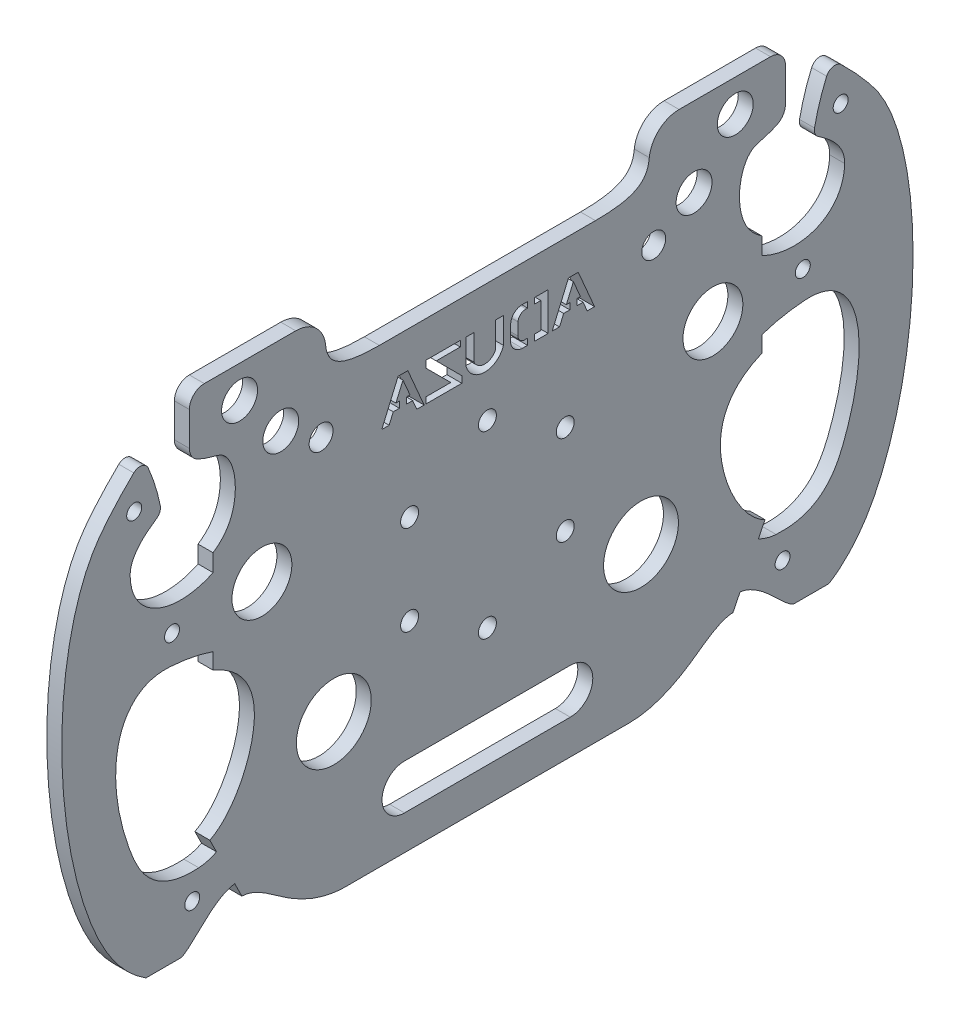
SolidWorks part; units mm, degrees
ref_plane "Front Plane" through (0, 0, 0) normal (0, 0, 1) x (1, 0, 0)
ref_plane "Top Plane" through (0, 0, 0) normal (0, 1, 0) x (1, 0, 0)
ref_plane "Right Plane" through (0, 0, 0) normal (1, 0, 0) x (0, 0, -1)
sketch "Sketch1" plane through (0, 0, 0) normal (1, 0, 0) x (0, 0, -1)
  line L0 (-119.7972, 154.2478) -> (520.2028, 154.2478) construction
sketch "Sketch2" plane through (0, 0, 0) normal (1, 0, 0) x (0, 0, -1)
  line L0 (0, 0) -> (0, -114.8232) construction
  line L1 (0, 0) -> (0, 135.3403) construction
  line L2 (36.0776, 77.2862) -> (-36.0776, 77.2862)
  line L3 (-91.6666, 13.2703) -> (-121.0851, 15.3716) construction
  line L4 (-63.9899, 95.4707) -> (-94.5192, 95.4707)
  line L5 (-99.5192, 90.4707) -> (-99.5192, 79.2297)
  line L6 (-93.4859, 73.1851) -> (-99.8854, 76.2618) construction
  line L7 (-114.505, 62.1949) -> (-114.0012, 39.5821) construction
  line L8 (-114.3916, 57.1045) -> (-114.0758, 42.93) construction
  line L9 (-110.3183, 14.6025) -> (-102.1435, 14.0186) construction
  line L10 (-104.6163, -39.1042) -> (-88.6872, -38.1199) construction
  line L11 (-89.9098, -38.1954) -> (-103.3938, -39.0286) construction
  line L12 (-47.4105, -73.6008) -> (47.4105, -73.6008)
  line L13 (-42.0447, -73.6008) -> (-52.7936, -73.6008) construction
  line L14 (-92.4432, -71.6519) -> (-109.4776, -71.6519) construction
  line L15 (114.0311, -71.6519) -> (102.2027, -71.6519)
  line L16 (99.5192, 90.4707) -> (99.5192, 79.2297)
  line L17 (63.9899, 95.4707) -> (94.5192, 95.4707)
  line L18 (-26.0151, 77.2862) -> (-46.1401, 77.2862) construction
  line L21 (-114.0311, -71.6519) -> (-102.2027, -71.6519)
  arc A0 (-54.0436, 86.5064) -> (-63.9899, 95.4707) centre (-63.9899, 85.4707) ccw
  arc A1 (-99.5192, 79.2297) -> (-96.6857, 74.7234) centre (-94.5192, 79.2297) ccw
  arc A2 (-94.5192, 95.4707) -> (-99.5192, 90.4707) centre (-94.5192, 90.4707) ccw
  arc A3 (-106.2246, 61.1913) -> (-103.9015, 66.2781) centre (-108.8336, 65.4567) ccw
  arc A4 (-110.5669, 86.4485) -> (-118.3195, 87.9515) centre (-115.027, 84.1886) ccw
  arc A5 (-116.6799, -70.8926) -> (-114.0311, -71.6519) centre (-114.0311, -66.6519) ccw
  arc A6 (116.6799, -70.8926) -> (114.0311, -71.6519) centre (114.0311, -66.6519) cw
  arc A7 (110.5669, 86.4485) -> (118.3195, 87.9515) centre (115.027, 84.1886) cw
  arc A8 (106.2246, 61.1913) -> (103.9015, 66.2781) centre (108.8336, 65.4567) cw
  arc A9 (94.5192, 95.4707) -> (99.5192, 90.4707) centre (94.5192, 90.4707) cw
  arc A10 (99.5192, 79.2297) -> (96.6857, 74.7234) centre (94.5192, 79.2297) cw
  arc A11 (54.0436, 86.5064) -> (63.9899, 95.4707) centre (63.9899, 85.4707) cw
  spline S0 degree 3 poles (-54.0436, 86.5064) (-53.7455, 83.6431) (-51.8652, 79.033) (-43.1803, 77.2862) (-36.0776, 77.2862) knots 0.310162 0.310162 0.310162 0.310162 0.655081 1 1 1 1
  spline S1 degree 3 poles (-96.6857, 74.7234) (-92.6846, 72.7998) (-84.6718, 73.4018) (-79.9826, 39.7627) (-113.9702, 38.1898) (-114.2851, 52.3228) knots 0 0 0 0 0.144743 0.476307 1 1 1 1
  spline S2 degree 3 poles (-114.2851, 52.3228) (-114.3139, 53.6179) (-112.9994, 56.3911) (-108.9403, 59.5302) (-106.2246, 61.1913) knots 0 0 0 0 0.431174 0.862348 0.862348 0.862348 0.862348
  spline S3 degree 3 poles (-110.5669, 86.4485) (-109.3772, 84.1006) (-106.5446, 77.7069) (-104.6414, 70.7208) (-103.9015, 66.2781) knots 0.195647 0.195647 0.195647 0.195647 0.445835 0.886101 0.886101 0.886101 0.886101
  spline S4 degree 3 poles (-118.3195, 87.9515) (-122.4147, 84.3682) (-127.0259, 79.5861) (-150.1062, 52.6286) (-151.2181, -14.6129) (-130.1901, -58.8432) (-122.0723, -67.5244) (-116.6799, -70.8926) knots 0.048714 0.048714 0.048714 0.048714 0.169988 0.25318 0.810911 0.891789 0.992245 0.992245 0.992245 0.992245
  spline S5 degree 3 poles (-106.2712, 14.3134) (-87.8846, 13.0001) (-68.2901, -3.3504) (-86.73, -37.999) (-96.6857, -38.6141) knots 0 0 0 0 0.501339 1 1 1 1
  spline S6 degree 3 poles (-106.2712, 14.3134) (-111.3804, 14.6784) (-115.5316, 11.4054) (-121.1809, -0.288) (-118.0643, -17.5033) (-110.8831, -34.6722) (-105.1132, -39.1349) (-96.6857, -38.6141) knots 0 0 0 0 0.114693 0.187207 0.665368 0.752624 1 1 1 1
  spline S7 degree 3 poles (-102.2027, -71.6519) (-96.9066, -71.6519) (-84.9595, -51.8628) (-66.8364, -68.7979) (-54.1285, -73.6008) (-47.4105, -73.6008) knots 0 0 0 0 0.325496 0.643297 1 1 1 1
  spline S8 degree 3 poles (102.2027, -71.6519) (96.9066, -71.6519) (84.9595, -51.8628) (66.8364, -68.7979) (54.1285, -73.6008) (47.4105, -73.6008) knots 0 0 0 0 0.325496 0.643297 1 1 1 1
  spline S9 degree 3 poles (106.2712, 14.3134) (111.3804, 14.6784) (115.5316, 11.4054) (121.1809, -0.288) (118.0643, -17.5033) (110.8831, -34.6722) (105.1132, -39.1349) (96.6857, -38.6141) knots 0 0 0 0 0.114693 0.187207 0.665368 0.752624 1 1 1 1
  spline S10 degree 3 poles (106.2712, 14.3134) (87.8846, 13.0001) (68.2901, -3.3504) (86.73, -37.999) (96.6857, -38.6141) knots 0 0 0 0 0.501339 1 1 1 1
  spline S11 degree 3 poles (118.3195, 87.9515) (122.4147, 84.3682) (127.0259, 79.5861) (150.1062, 52.6286) (151.2181, -14.6129) (130.1901, -58.8432) (122.0723, -67.5244) (116.6799, -70.8926) knots 0.048714 0.048714 0.048714 0.048714 0.169988 0.25318 0.810911 0.891789 0.992245 0.992245 0.992245 0.992245
  spline S12 degree 3 poles (110.5669, 86.4485) (109.3772, 84.1006) (106.5446, 77.7069) (104.6414, 70.7208) (103.9015, 66.2781) knots 0.195647 0.195647 0.195647 0.195647 0.445835 0.886101 0.886101 0.886101 0.886101
  spline S13 degree 3 poles (114.2851, 52.3228) (114.3139, 53.6179) (112.9994, 56.3911) (108.9403, 59.5302) (106.2246, 61.1913) knots 0 0 0 0 0.431174 0.862348 0.862348 0.862348 0.862348
  spline S14 degree 3 poles (96.6857, 74.7234) (92.6846, 72.7998) (84.6718, 73.4018) (79.9826, 39.7627) (113.9702, 38.1898) (114.2851, 52.3228) knots 0 0 0 0 0.144743 0.476307 1 1 1 1
  spline S15 degree 3 poles (54.0436, 86.5064) (53.7455, 83.6431) (51.8652, 79.033) (43.1803, 77.2862) (36.0776, 77.2862) knots 0.310162 0.310162 0.310162 0.310162 0.655081 1 1 1 1
  point P26 (0, 77.2862)
  point P99 (0, -73.6008)
  dimension "D1" = 10
  dimension "D2" = 5
  dimension "D3" = 5
extrude "Boss-Extrude1" add sketch "Sketch2" along normal blind 5
sketch "Sketch3" plane through (5, 0, 0) normal (1, 0, 0) x (0, 0, -1)
  line L2 (0, 0) -> (0, -34.1704) construction
  line L3 (-91.6123, 16.5065) -> (-91.6123, -1.655)
  line L4 (-114.0311, 101.5931) -> (-189.6235, 64.0123)
  line L5 (-189.6235, 64.0123) -> (-156.593, -92.0213)
  line L6 (-156.593, -92.0213) -> (-74.2322, -74.5864)
  line L7 (-74.2322, -74.5864) -> (-84.3708, -54.1929)
  line L8 (-90.4507, -41.9636) -> (-101.2721, -20.1968)
  line L9 (-91.6123, 39.3595) -> (-91.6123, 52.2114)
  line L10 (-114.0311, 101.5931) -> (-91.6123, 52.2114)
  line L11 (-91.6123, -1.655) -> (-101.2721, -20.1968)
  line L12 (91.6123, 16.5065) -> (91.6123, -1.655)
  line L13 (91.6123, -1.655) -> (101.2721, -20.1968)
  line L14 (90.4507, -41.9636) -> (101.2721, -20.1968)
  line L15 (114.0311, -66.6519) -> (102.2592, -66.6519)
  line L16 (91.6123, 39.3595) -> (91.6123, 52.2114)
  line L17 (114.0311, 101.5931) -> (91.6123, 52.2114)
  line L18 (114.0311, 101.5931) -> (189.6235, 64.0123)
  line L19 (189.6235, 64.0123) -> (156.593, -92.0213)
  line L20 (156.593, -92.0213) -> (74.2322, -74.5864)
  line L21 (74.2322, -74.5864) -> (84.3708, -54.1929)
  line L24 (-63.9899, 90.4707) -> (-94.5192, 90.4707)
  line L25 (-94.5192, 90.4707) -> (-94.5192, 79.2297)
  line L26 (-114.0311, -66.6519) -> (-102.2592, -66.6519)
  line L27 (-47.4105, -68.6008) -> (47.4105, -68.6008)
  line L28 (102.2592, -66.6519) -> (114.0311, -66.6519)
  line L29 (94.5192, 79.2297) -> (94.5192, 90.4707)
  line L30 (94.5192, 90.4707) -> (63.9899, 90.4707)
  line L31 (36.0776, 72.2862) -> (-36.0776, 72.2862)
  line L34 (-114.0311, -66.6519) -> (-102.2592, -66.6519)
  arc A36 (-59.0167, 85.9886) -> (-63.9899, 90.4707) centre (-63.9899, 85.4707) ccw
  arc A37 (63.9899, 90.4707) -> (59.0167, 85.9886) centre (63.9899, 85.4707) ccw
  spline S3 degree 3 poles (-91.6123, 16.5065) (-92.5161, 16.8272) (-93.4302, 17.1154) (-96.2246, 17.9023) (-98.1326, 18.3124) (-102.0078, 18.9431) (-103.957, 19.1609) (-105.9149, 19.3007) knots 0.844181 0.844181 0.844181 0.844181 0.875 0.875 0.9375 0.9375 1 1 1 1
  spline S4 degree 3 poles (96.3773, -43.6046) (95.3856, -43.5433) (94.4206, -43.3781) (93.0077, -42.9954) (92.5426, -42.8452) (91.6234, -42.5018) (91.1674, -42.3077) (90.6306, -42.052) (90.5404, -42.0081) (90.4507, -41.9636) knots 0 0 0 0 0.03125 0.03125 0.046875 0.046875 0.0625 0.0625 0.065675 0.065675 0.065675 0.065675
  spline S5 degree 3 poles (105.9149, 19.3007) (106.8449, 19.3672) (107.7707, 19.3768) (109.612, 19.2581) (110.5275, 19.1299) (111.8914, 18.8095) (112.3402, 18.6821) (113.2176, 18.3867) (114.0774, 18.0501) (114.9008, 17.6286) (115.7052, 17.1629) (116.0995, 16.9066) (117.2282, 16.0876) (117.9159, 15.4712) (118.8624, 14.4539) (119.1644, 14.0984) (119.7401, 13.364) (120.0118, 12.9879) (120.7778, 11.8324) (121.2225, 11.0258) (121.8004, 9.7666) (121.9784, 9.3387) (122.3094, 8.4694) (122.4627, 8.0289) (123.1688, 5.822) (123.5473, 4.0222) (123.9081, 1.2842) (123.9935, 0.3651) (124.1025, -1.4846) (124.1258, -2.4133) (124.1143, -5.1804) (123.9998, -7.0118) (123.6064, -10.6541) (123.3272, -12.4649) (122.6311, -16.0694) (122.2136, -17.8648) (121.2568, -21.4327) (120.7201, -23.1957) (119.8333, -25.8108) (119.5239, -26.6775) (118.8776, -28.4011) (118.5402, -29.2577) (117.8112, -30.9516) (117.4188, -31.7908) (116.5574, -33.4313) (116.0913, -34.2269) (115.0704, -35.7566) (114.5157, -36.4906) (113.6039, -37.5363) (113.2852, -37.877) (112.6272, -38.5302) (111.6102, -39.4674) (110.1329, -40.5455) (108.9326, -41.2235) (108.1117, -41.6461) (107.689, -41.8436) (105.5508, -42.7458) (103.7663, -43.1989) (100.0823, -43.6882) (98.2309, -43.7192) (96.3773, -43.6046) knots 0 0 0 0 0.03125 0.03125 0.0625 0.0625 0.078125 0.078125 0.09375 0.109375 0.109375 0.125 0.125 0.15625 0.15625 0.171875 0.171875 0.1875 0.1875 0.21875 0.21875 0.234375 0.234375 0.25 0.25 0.3125 0.3125 0.34375 0.34375 0.375 0.375 0.4375 0.4375 0.5 0.5 0.5625 0.5625 0.625 0.625 0.65625 0.65625 0.6875 0.6875 0.71875 0.71875 0.75 0.75 0.78125 0.78125 0.796875 0.796875 0.8125 0.84375 0.859375 0.859375 0.875 0.875 0.9375 0.9375 1 1 1 1
  spline S6 degree 3 poles (91.6123, 16.5065) (92.5161, 16.8272) (93.4302, 17.1154) (96.2246, 17.9023) (98.1326, 18.3124) (102.0078, 18.9431) (103.957, 19.1609) (105.9149, 19.3007) knots 0.844181 0.844181 0.844181 0.844181 0.875 0.875 0.9375 0.9375 1 1 1 1
  spline S7 degree 3 poles (102.2592, -66.6519) (102.1776, -66.6314) (102.1019, -66.6011) (101.9521, -66.5374) (101.7326, -66.433) (101.5226, -66.3125) (101.1097, -66.0591) (100.844, -65.8737) (100.0621, -65.2918) (99.5665, -64.8743) (98.11, -63.5904) (97.1792, -62.6903) (95.3065, -60.9021) (94.3666, -60.0104) (92.4255, -58.3075) (91.4253, -57.495) (89.8284, -56.4025) (89.2798, -56.0597) (88.138, -55.4325) (87.5505, -55.1518) (86.3501, -54.6788) (85.7349, -54.4861) (84.8619, -54.284) (84.6171, -54.2349) (84.3708, -54.1929) knots 0 0 0 0 0.003906 0.003906 0.007813 0.015625 0.015625 0.03125 0.03125 0.0625 0.0625 0.125 0.125 0.1875 0.1875 0.25 0.25 0.28125 0.28125 0.3125 0.3125 0.34375 0.34375 0.355726 0.355726 0.355726 0.355726
  spline S8 degree 3 poles (115.027, 84.1886) (116.3472, 83.0334) (117.6398, 81.8534) (120.1473, 79.4231) (121.361, 78.1717) (123.1373, 76.2547) (123.7225, 75.6095) (124.8843, 74.3113) (125.4622, 73.6594) (127.1712, 71.6816) (128.2758, 70.3318) (129.8261, 68.2106) (130.3252, 67.4876) (131.2807, 66.003) (131.7307, 65.249) (133.006, 62.9609) (133.7608, 61.3999) (135.132, 58.2262) (135.7478, 56.6132) (136.8693, 53.3462) (137.3747, 51.692) (138.2936, 48.3493) (138.7069, 46.6606) (139.2667, 44.1052) (139.4431, 43.25) (139.7756, 41.5406) (139.9319, 40.6854) (140.6669, 36.407) (141.108, 32.9767) (141.7527, 26.1041) (141.9555, 22.6617) (142.1495, 15.766) (142.1404, 12.3127) (141.9749, 7.125) (141.8943, 5.3944) (141.6822, 1.9308) (141.5505, 0.1954) (141.0794, -4.9972) (140.6651, -8.4367) (139.6293, -15.2701) (139.008, -18.6639) (137.538, -25.4013) (136.6896, -28.7449) (134.7265, -35.3732) (133.613, -38.6582) (131.6872, -43.5292) (131.0047, -45.1338) (129.5356, -48.2847) (128.7486, -49.832) (127.0418, -52.8554) (126.1218, -54.3315) (124.6197, -56.4801) (124.0976, -57.1868) (123.0211, -58.5608) (122.4658, -59.2298) (120.7452, -61.1796) (119.5257, -62.4035) (116.9163, -64.6724) (115.5267, -65.7177) (114.0311, -66.6519) knots 0 0 0 0 0.03125 0.03125 0.0625 0.0625 0.078125 0.078125 0.09375 0.09375 0.125 0.125 0.140625 0.140625 0.15625 0.15625 0.1875 0.1875 0.21875 0.21875 0.25 0.25 0.28125 0.28125 0.296875 0.296875 0.3125 0.3125 0.375 0.375 0.4375 0.4375 0.5 0.5 0.53125 0.53125 0.5625 0.5625 0.625 0.625 0.6875 0.6875 0.75 0.75 0.8125 0.8125 0.84375 0.84375 0.875 0.875 0.90625 0.90625 0.921875 0.921875 0.9375 0.9375 0.96875 0.96875 1 1 1 1
  spline S9 degree 3 poles (108.8336, 65.4567) (109.105, 67.0863) (109.4423, 68.7018) (110.2394, 71.9064) (110.6989, 73.4935) (111.7354, 76.6278) (112.3134, 78.1767) (113.5854, 81.2194) (114.2804, 82.7152) (115.027, 84.1886) knots 0 0 0 0 0.25 0.25 0.5 0.5 0.75 0.75 1 1 1 1
  spline S10 degree 3 poles (119.2838, 52.2114) (119.3004, 52.9567) (119.2214, 53.6868) (118.9755, 54.7618) (118.8717, 55.1179) (118.6245, 55.8185) (118.4826, 56.1589) (118.0093, 57.1536) (117.6301, 57.7818) (116.9859, 58.6828) (116.758, 58.9765) (116.2869, 59.5437) (116.0429, 59.8182) (114.787, 61.1528) (113.6716, 62.1023) (111.9084, 63.4304) (111.3058, 63.8558) (110.0831, 64.6764) (109.4621, 65.0722) (108.8336, 65.4567) knots 0 0 0 0 0.125 0.125 0.1875 0.1875 0.25 0.25 0.375 0.375 0.4375 0.4375 0.5 0.5 0.75 0.75 0.875 0.875 1 1 1 1
  spline S11 degree 3 poles (91.6123, 39.3595) (91.7008, 39.3163) (91.7896, 39.2735) (92.3013, 39.0311) (92.7319, 38.8419) (93.6013, 38.4887) (94.0392, 38.325) (96.2438, 37.5694) (98.0553, 37.1616) (100.3834, 36.913) (100.8534, 36.8767) (101.789, 36.8326) (102.2557, 36.8246) (103.6521, 36.8442) (104.5785, 36.9146) (105.9603, 37.1149) (106.4197, 37.1976) (107.3356, 37.397) (107.7936, 37.5144) (109.1415, 37.9157) (110.0113, 38.2495) (111.2689, 38.8589) (111.6802, 39.0802) (112.4858, 39.5619) (112.8813, 39.8234) (114.0154, 40.6521) (114.7102, 41.2679) (115.6581, 42.2888) (115.9583, 42.6454) (116.5259, 43.3925) (116.7939, 43.7843) (117.5295, 44.9834) (117.9359, 45.8221) (118.4272, 47.1354) (118.5714, 47.5832) (118.8197, 48.4936) (118.9228, 48.9518) (119.1734, 50.3349) (119.2628, 51.2682) (119.2838, 52.2114) knots 0.590454 0.590454 0.590454 0.590454 0.59375 0.59375 0.609375 0.609375 0.625 0.625 0.6875 0.6875 0.703125 0.703125 0.71875 0.71875 0.75 0.75 0.765625 0.765625 0.78125 0.78125 0.8125 0.8125 0.828125 0.828125 0.84375 0.84375 0.875 0.875 0.890625 0.890625 0.90625 0.90625 0.9375 0.9375 0.953125 0.953125 0.96875 0.96875 1 1 1 1
  spline S36 degree 3 poles (75.4969, -921.4682) (86.7852, 151.1678) (20.6434, 69.4106) (-41.06, 72.4332) (-42.3015, 72.5297) (-44.7774, 72.8305) (-46.0143, 73.0356) (-48.4322, 73.606) (-49.6175, 73.971) (-51.3403, 74.7057) (-51.9074, 74.9838) (-52.9912, 75.6025) (-53.5108, 75.9439) (-54.2525, 76.5105) (-54.4934, 76.7085) (-54.9618, 77.1237) (-55.1903, 77.342) (-55.8451, 78.018) (-56.2415, 78.4969) (-56.9559, 79.5099) (-57.2739, 80.044) (-57.6926, 80.886) (-57.8226, 81.174) (-58.0595, 81.7533) (-58.1671, 82.0457) (-69.4265, 116.0495) (49.4143, 183.2787) (-1047.8307, -63.0518) knots -5.950291 -5.950291 -5.950291 -5.950291 0.125 0.125 0.25 0.25 0.375 0.375 0.5 0.5 0.5625 0.5625 0.625 0.625 0.65625 0.65625 0.6875 0.6875 0.75 0.75 0.8125 0.8125 0.84375 0.84375 0.875 0.875 4.446236 4.446236 4.446236 4.446236 only from (-36.0776, 72.2862) to (-59.0167, 85.9886)
  spline S37 degree 3 number of poles 90 (-94.5192, 79.2297) -> (-119.2838, 52.2114)
  spline S38 degree 3 poles (3805.4458, -711.2794) (212.3131, -93.855) (-129.6232, 8.2124) (-118.9755, 54.7618) (-118.8717, 55.1179) (-118.6245, 55.8185) (-118.4826, 56.1589) (-118.0093, 57.1536) (-117.6301, 57.7818) (-116.9859, 58.6828) (-116.758, 58.9765) (-116.2869, 59.5437) (-116.0429, 59.8182) (-114.787, 61.1528) (-113.6716, 62.1023) (-111.9084, 63.4304) (-111.3058, 63.8558) (-45.3855, 108.0951) (129.8689, -13.2904) (-2123.1773, 3514.3193) knots -7.931619 -7.931619 -7.931619 -7.931619 0.125 0.125 0.1875 0.1875 0.25 0.25 0.375 0.375 0.4375 0.4375 0.5 0.5 0.75 0.75 0.875 0.875 14.228277 14.228277 14.228277 14.228277 only from (-119.2838, 52.2114) to (-108.8336, 65.4567)
  spline S39 degree 3 poles (-3901.5794, -1165.1116) (-464.8781, -285.9589) (-76.7966, -62.5372) (-110.2394, 71.9064) (-110.6989, 73.4935) (-111.7354, 76.6278) (-112.3134, 78.1767) (-168.308, 212.1168) (-670.9785, 150.6038) (3344.7282, 2048.0302) knots -20.47652 -20.47652 -20.47652 -20.47652 0.25 0.25 0.5 0.5 0.75 0.75 22.510105 22.510105 22.510105 22.510105 only from (-108.8336, 65.4567) to (-115.027, 84.1886)
  spline S40 degree 3 poles (-2829.3364, 3004.4651) (227.4376, 84.5731) (-34.3044, 162.6255) (-120.1473, 79.4231) (-121.361, 78.1717) (-123.1373, 76.2547) (-123.7225, 75.6095) (-124.8843, 74.3113) (-125.4622, 73.6594) (-127.1712, 71.6816) (-128.2758, 70.3318) (-129.8261, 68.2106) (-130.3252, 67.4876) (-131.2807, 66.003) (-131.7307, 65.249) (-133.006, 62.9609) (-133.7608, 61.3999) (-135.132, 58.2262) (-135.7478, 56.6132) (-136.8693, 53.3462) (-137.3747, 51.692) (-138.2936, 48.3493) (-138.7069, 46.6606) (-139.2667, 44.1052) (-139.4431, 43.25) (-139.7756, 41.5406) (-139.9319, 40.6854) (-140.6669, 36.407) (-141.108, 32.9767) (-141.7527, 26.1041) (-141.9555, 22.6617) (-142.1495, 15.766) (-142.1404, 12.3127) (-141.9749, 7.125) (-141.8943, 5.3944) (-141.6822, 1.9308) (-141.5505, 0.1954) (-141.0794, -4.9972) (-140.6651, -8.4367) (-139.6293, -15.2701) (-139.008, -18.6639) (-137.538, -25.4013) (-136.6896, -28.7449) (-134.7265, -35.3732) (-133.613, -38.6582) (-131.6872, -43.5292) (-131.0047, -45.1338) (-129.5356, -48.2847) (-128.7486, -49.832) (-127.0418, -52.8554) (-126.1218, -54.3315) (-124.6197, -56.4801) (-124.0976, -57.1868) (-123.0211, -58.5608) (-122.4658, -59.2298) (-120.7452, -61.1796) (-119.5257, -62.4035) (-56.9001, -116.8573) (192.017, 26.7126) (2809.4819, 2656.1614) knots -2.077176 -2.077176 -2.077176 -2.077176 0.03125 0.03125 0.0625 0.0625 0.078125 0.078125 0.09375 0.09375 0.125 0.125 0.140625 0.140625 0.15625 0.15625 0.1875 0.1875 0.21875 0.21875 0.25 0.25 0.28125 0.28125 0.296875 0.296875 0.3125 0.3125 0.375 0.375 0.4375 0.4375 0.5 0.5 0.53125 0.53125 0.5625 0.5625 0.625 0.625 0.6875 0.6875 0.75 0.75 0.8125 0.8125 0.84375 0.84375 0.875 0.875 0.90625 0.90625 0.921875 0.921875 0.9375 0.9375 0.96875 0.96875 2.437504 2.437504 2.437504 2.437504 only from (-115.027, 84.1886) to (-114.0311, -66.6519)
  spline S41 degree 3 poles (-2134.2733, 3377.594) (-117.8121, -63.2193) (-107.5657, -68.9246) (-101.9521, -66.5374) (-101.7326, -66.433) (-101.5226, -66.3125) (-101.1097, -66.0591) (-100.844, -65.8737) (-100.0621, -65.2918) (-99.5665, -64.8743) (-98.11, -63.5904) (-97.1792, -62.6903) (-95.3065, -60.9021) (-94.3666, -60.0104) (-92.4255, -58.3075) (-91.4253, -57.495) (-89.8284, -56.4025) (-89.2798, -56.0597) (-88.138, -55.4325) (-87.5505, -55.1518) (-86.3501, -54.6788) (-85.7349, -54.4861) (-84.4726, -54.1939) (-83.8217, -54.0948) (-82.5308, -53.9969) (-81.8862, -53.9965) (-80.9205, -54.0638) (-80.5988, -54.0976) (-79.9558, -54.1871) (-79.6333, -54.2431) (-78.0395, -54.5722) (-76.8216, -54.9902) (-74.4621, -56.0326) (-73.3192, -56.659) (-71.0968, -58.0201) (-70.0143, -58.7563) (-67.8671, -60.2632) (-66.8029, -61.0348) (-65.1881, -62.1563) (-64.6465, -62.5236) (-63.5507, -63.2341) (-62.9971, -63.5783) (-61.3175, -64.5742) (-60.1728, -65.1898) (-57.8217, -66.3016) (-56.6155, -66.7981) (-54.1245, -67.6387) (-52.8398, -67.9832) (-50.8335, -68.3461) (-50.1492, -68.4411) (26.7836, -75.5889) (131.068, 300.1054) (471.0081, 3893.3921) knots -0.285023 -0.285023 -0.285023 -0.285023 0.003906 0.003906 0.007813 0.015625 0.015625 0.03125 0.03125 0.0625 0.0625 0.125 0.125 0.1875 0.1875 0.25 0.25 0.28125 0.28125 0.3125 0.3125 0.34375 0.34375 0.375 0.375 0.40625 0.40625 0.421875 0.421875 0.4375 0.4375 0.5 0.5 0.5625 0.5625 0.625 0.625 0.6875 0.6875 0.71875 0.71875 0.75 0.75 0.8125 0.8125 0.875 0.875 0.9375 0.9375 0.96875 0.96875 4.457723 4.457723 4.457723 4.457723 only from (-102.2592, -66.6519) to (-47.4105, -68.6008)
  spline S42 degree 3 poles (-275.3042, 877.8892) (-50.3785, 17.0557) (11.0133, -75.2011) (52.5719, -68.0417) (53.8242, -67.7232) (55.6761, -67.1207) (56.289, -66.8991) (57.5065, -66.4172) (58.1096, -66.1576) (59.8879, -65.3356) (61.039, -64.7276) (63.286, -63.4162) (64.3807, -62.7103) (66.5303, -61.2295) (67.5894, -60.4623) (69.7247, -58.9562) (70.8006, -58.2161) (72.4614, -57.1797) (73.0228, -56.8465) (74.1679, -56.2153) (74.7533, -55.9165) (76.5427, -55.0959) (77.7697, -54.6539) (79.6854, -54.2231) (80.3405, -54.1185) (81.64, -54.0041) (82.2881, -53.9929) (83.5808, -54.0667) (84.2255, -54.1517) (85.1897, -54.3559) (85.5111, -54.437) (86.1411, -54.6218) (86.4511, -54.7257) (87.3673, -55.0707) (87.9596, -55.3442) (89.1142, -55.9614) (89.6782, -56.3064) (91.308, -57.4038) (92.3235, -58.2224) (94.2898, -59.939) (95.2395, -60.8383) (97.132, -62.645) (98.072, -63.5551) (99.5427, -64.8542) (100.0441, -65.2774) (100.8299, -65.8637) (101.0975, -66.0511) (101.5156, -66.3085) (101.6583, -66.3906) (101.8777, -66.502) (101.9517, -66.5372) (105.6009, -68.0888) (110.8335, -65.8095) (512.8291, 845.0783) knots -1.914732 -1.914732 -1.914732 -1.914732 0.0625 0.0625 0.125 0.125 0.15625 0.15625 0.1875 0.1875 0.25 0.25 0.3125 0.3125 0.375 0.375 0.4375 0.4375 0.46875 0.46875 0.5 0.5 0.5625 0.5625 0.59375 0.59375 0.625 0.625 0.65625 0.65625 0.671875 0.671875 0.6875 0.6875 0.71875 0.71875 0.75 0.75 0.8125 0.8125 0.875 0.875 0.9375 0.9375 0.96875 0.96875 0.984375 0.984375 0.992188 0.992188 0.996094 0.996094 1.181299 1.181299 1.181299 1.181299 only from (47.4105, -68.6008) to (102.2592, -66.6519)
  spline S43 degree 3 poles (-669.6015, 554.5613) (-23.6741, -56.1052) (81.2642, -95.6941) (119.5376, -62.3923) (120.7599, -61.1645) (122.4845, -59.2078) (123.0411, -58.5364) (124.1199, -57.1571) (124.6427, -56.4483) (126.1443, -54.2968) (127.0628, -52.8204) (129.6172, -48.2887) (131.054, -45.132) (132.9729, -40.2766) (133.5749, -38.6348) (134.7018, -35.339) (135.2273, -33.6841) (136.7018, -28.7004) (137.5497, -25.3529) (139.0174, -18.6154) (139.6369, -15.2254) (140.6688, -8.4069) (141.0812, -4.9785) (141.5502, 0.192) (141.6815, 1.9201) (141.8939, 5.3857) (141.975, 7.1254) (142.141, 12.3346) (142.1494, 15.7984) (141.9535, 22.7072) (141.7492, 26.1523) (141.1028, 33.0215) (140.6611, 36.4457) (139.7808, 41.5628) (139.4508, 43.2653) (138.8924, 45.8134) (138.6957, 46.6619) (138.279, 48.3567) (138.0591, 49.2031) (137.3653, 51.7246) (136.8565, 53.3869) (135.7281, 56.6669) (135.1089, 58.2845) (133.7311, 61.4637) (132.9732, 63.0253) (131.6947, 65.3105) (131.2433, 66.0637) (130.2885, 67.542) (129.7898, 68.2619) (128.2417, 70.3747) (127.1393, 71.7197) (125.4343, 73.691) (124.858, 74.3409) (123.6993, 75.6352) (123.1156, 76.2784) (121.344, 78.1895) (120.1334, 79.437) (63.9519, 133.8725) (-65.6671, 119.7068) (688.7626, 903.2031) knots -0.852182 -0.852182 -0.852182 -0.852182 0.03125 0.03125 0.0625 0.0625 0.078125 0.078125 0.09375 0.09375 0.125 0.125 0.1875 0.1875 0.21875 0.21875 0.25 0.25 0.3125 0.3125 0.375 0.375 0.4375 0.4375 0.46875 0.46875 0.5 0.5 0.5625 0.5625 0.625 0.625 0.6875 0.6875 0.71875 0.71875 0.734375 0.734375 0.75 0.75 0.78125 0.78125 0.8125 0.8125 0.84375 0.84375 0.859375 0.859375 0.875 0.875 0.90625 0.90625 0.921875 0.921875 0.9375 0.9375 0.96875 0.96875 2.341588 2.341588 2.341588 2.341588 only from (114.0311, -66.6519) to (115.027, 84.1886)
  spline S44 degree 3 poles (-644.075, 735.1595) (378.5521, 166.5985) (149.4117, 166.9297) (112.3113, 78.1715) (111.7338, 76.6235) (110.6976, 73.4891) (110.238, 71.9011) (90.7877, -6.3083) (211.1709, -115.4982) (1003.2963, -381.6475) knots -14.065511 -14.065511 -14.065511 -14.065511 0.25 0.25 0.5 0.5 0.75 0.75 12.718954 12.718954 12.718954 12.718954 only from (115.027, 84.1886) to (108.8336, 65.4567)
  spline S45 degree 3 poles (569.8981, 952.8221) (-20.2236, 43.0391) (73.9596, 92.003) (113.076, 62.5512) (113.6505, 62.0902) (114.7606, 61.1209) (115.2917, 60.6164) (116.2902, 59.5554) (116.7579, 58.9989) (117.3953, 58.1115) (117.5971, 57.8069) (117.9754, 57.177) (118.1526, 56.8504) (118.635, 55.8427) (118.8849, 55.1485) (119.1351, 54.0683) (119.1978, 53.6999) (122.5539, 21.9605) (-41.107, -18.8243) (-869.4997, -97.0957) knots -7.955972 -7.955972 -7.955972 -7.955972 0.25 0.25 0.375 0.375 0.5 0.5 0.625 0.625 0.6875 0.6875 0.75 0.75 0.875 0.875 0.9375 0.9375 6.220131 6.220131 6.220131 6.220131 only from (108.8336, 65.4567) to (119.2838, 52.2114)
  spline S46 degree 3 number of poles 83 (119.2838, 52.2114) -> (94.5192, 79.2297)
  spline S47 degree 3 poles (1044.716, -82.5178) (-50.9857, 187.3835) (69.5109, 116.4061) (58.0751, 81.766) (57.8425, 81.1902) (57.4247, 80.3459) (57.2741, 80.0684) (56.9549, 79.5307) (56.7857, 79.2691) (56.2491, 78.5065) (55.853, 78.0273) (55.2011, 77.3526) (54.9732, 77.1342) (54.5033, 76.7168) (54.2618, 76.518) (53.5184, 75.9491) (52.9981, 75.6067) (51.9136, 74.987) (51.3464, 74.7085) (49.6223, 73.9726) (48.4367, 73.6073) (46.6235, 73.1792) (46.0132, 73.0568) (44.7831, 72.8452) (44.1634, 72.756) (42.3051, 72.5299) (41.0627, 72.4334) (-20.6155, 69.4101) (-86.5361, 151.1175) (-77.6686, -921.2231) knots -3.50294 -3.50294 -3.50294 -3.50294 0.125 0.125 0.1875 0.1875 0.21875 0.21875 0.25 0.25 0.3125 0.3125 0.34375 0.34375 0.375 0.375 0.4375 0.4375 0.5 0.5 0.625 0.625 0.6875 0.6875 0.75 0.75 0.875 0.875 6.944123 6.944123 6.944123 6.944123 only from (59.0167, 85.9886) to (36.0776, 72.2862)
  spline S49 degree 3 poles (-91.6123, 39.3595) (-91.7008, 39.3163) (-91.7896, 39.2735) (-92.3013, 39.0311) (-92.7319, 38.8419) (-93.6013, 38.4887) (-94.0392, 38.325) (-96.2438, 37.5694) (-98.0553, 37.1616) (-100.3834, 36.913) (-100.8534, 36.8767) (-101.789, 36.8326) (-102.2557, 36.8246) (-103.6521, 36.8442) (-104.5785, 36.9146) (-105.9603, 37.1149) (-106.4197, 37.1976) (-107.3356, 37.397) (-107.7936, 37.5144) (-109.1415, 37.9157) (-110.0113, 38.2495) (-111.2689, 38.8589) (-111.6802, 39.0802) (-112.4858, 39.5619) (-112.8813, 39.8234) (-114.0154, 40.6521) (-114.7102, 41.2679) (-115.6581, 42.2888) (-115.9583, 42.6454) (-116.5259, 43.3925) (-116.7939, 43.7843) (-117.5295, 44.9834) (-117.9359, 45.8221) (-118.4272, 47.1354) (-118.5714, 47.5832) (-118.8197, 48.4936) (-118.9228, 48.9518) (-119.1734, 50.3349) (-119.2628, 51.2682) (-119.2838, 52.2114) knots 0.590454 0.590454 0.590454 0.590454 0.59375 0.59375 0.609375 0.609375 0.625 0.625 0.6875 0.6875 0.703125 0.703125 0.71875 0.71875 0.75 0.75 0.765625 0.765625 0.78125 0.78125 0.8125 0.8125 0.828125 0.828125 0.84375 0.84375 0.875 0.875 0.890625 0.890625 0.90625 0.90625 0.9375 0.9375 0.953125 0.953125 0.96875 0.96875 1 1 1 1
  spline S50 degree 3 poles (-119.2838, 52.2114) (-119.3004, 52.9567) (-119.2214, 53.6868) (-118.9755, 54.7618) (-118.8717, 55.1179) (-118.6245, 55.8185) (-118.4826, 56.1589) (-118.0093, 57.1536) (-117.6301, 57.7818) (-116.9859, 58.6828) (-116.758, 58.9765) (-116.2869, 59.5437) (-116.0429, 59.8182) (-114.787, 61.1528) (-113.6716, 62.1023) (-111.9084, 63.4304) (-111.3058, 63.8558) (-110.0831, 64.6764) (-109.4621, 65.0722) (-108.8336, 65.4567) knots 0 0 0 0 0.125 0.125 0.1875 0.1875 0.25 0.25 0.375 0.375 0.4375 0.4375 0.5 0.5 0.75 0.75 0.875 0.875 1 1 1 1
  spline S51 degree 3 poles (-108.8336, 65.4567) (-109.105, 67.0863) (-109.4423, 68.7018) (-110.2394, 71.9064) (-110.6989, 73.4935) (-111.7354, 76.6278) (-112.3134, 78.1767) (-113.5854, 81.2194) (-114.2804, 82.7152) (-115.027, 84.1886) knots 0 0 0 0 0.25 0.25 0.5 0.5 0.75 0.75 1 1 1 1
  spline S52 degree 3 poles (-115.027, 84.1886) (-116.3472, 83.0334) (-117.6398, 81.8534) (-120.1473, 79.4231) (-121.361, 78.1717) (-123.1373, 76.2547) (-123.7225, 75.6095) (-124.8843, 74.3113) (-125.4622, 73.6594) (-127.1712, 71.6816) (-128.2758, 70.3318) (-129.8261, 68.2106) (-130.3252, 67.4876) (-131.2807, 66.003) (-131.7307, 65.249) (-133.006, 62.9609) (-133.7608, 61.3999) (-135.132, 58.2262) (-135.7478, 56.6132) (-136.8693, 53.3462) (-137.3747, 51.692) (-138.2936, 48.3493) (-138.7069, 46.6606) (-139.2667, 44.1052) (-139.4431, 43.25) (-139.7756, 41.5406) (-139.9319, 40.6854) (-140.6669, 36.407) (-141.108, 32.9767) (-141.7527, 26.1041) (-141.9555, 22.6617) (-142.1495, 15.766) (-142.1404, 12.3127) (-141.9749, 7.125) (-141.8943, 5.3944) (-141.6822, 1.9308) (-141.5505, 0.1954) (-141.0794, -4.9972) (-140.6651, -8.4367) (-139.6293, -15.2701) (-139.008, -18.6639) (-137.538, -25.4013) (-136.6896, -28.7449) (-134.7265, -35.3732) (-133.613, -38.6582) (-131.6872, -43.5292) (-131.0047, -45.1338) (-129.5356, -48.2847) (-128.7486, -49.832) (-127.0418, -52.8554) (-126.1218, -54.3315) (-124.6197, -56.4801) (-124.0976, -57.1868) (-123.0211, -58.5608) (-122.4658, -59.2298) (-120.7452, -61.1796) (-119.5257, -62.4035) (-116.9163, -64.6724) (-115.5267, -65.7177) (-114.0311, -66.6519) knots 0 0 0 0 0.03125 0.03125 0.0625 0.0625 0.078125 0.078125 0.09375 0.09375 0.125 0.125 0.140625 0.140625 0.15625 0.15625 0.1875 0.1875 0.21875 0.21875 0.25 0.25 0.28125 0.28125 0.296875 0.296875 0.3125 0.3125 0.375 0.375 0.4375 0.4375 0.5 0.5 0.53125 0.53125 0.5625 0.5625 0.625 0.625 0.6875 0.6875 0.75 0.75 0.8125 0.8125 0.84375 0.84375 0.875 0.875 0.90625 0.90625 0.921875 0.921875 0.9375 0.9375 0.96875 0.96875 1 1 1 1
  spline S53 degree 3 poles (-102.2592, -66.6519) (-102.1776, -66.6314) (-102.1019, -66.6011) (-101.9521, -66.5374) (-101.7326, -66.433) (-101.5226, -66.3125) (-101.1097, -66.0591) (-100.844, -65.8737) (-100.0621, -65.2918) (-99.5665, -64.8743) (-98.11, -63.5904) (-97.1792, -62.6903) (-95.3065, -60.9021) (-94.3666, -60.0104) (-92.4255, -58.3075) (-91.4253, -57.495) (-89.8284, -56.4025) (-89.2798, -56.0597) (-88.138, -55.4325) (-87.5505, -55.1518) (-86.3501, -54.6788) (-85.7349, -54.4861) (-84.8619, -54.284) (-84.6171, -54.2349) (-84.3708, -54.1929) knots 0 0 0 0 0.003906 0.003906 0.007813 0.015625 0.015625 0.03125 0.03125 0.0625 0.0625 0.125 0.125 0.1875 0.1875 0.25 0.25 0.28125 0.28125 0.3125 0.3125 0.34375 0.34375 0.355726 0.355726 0.355726 0.355726
  spline S65 degree 3 poles (-196.0491, 4013.2255) (57.8999, -359.1164) (-39.7136, 23.764) (-109.612, 19.2581) (-110.5275, 19.1299) (-111.8914, 18.8095) (-112.3402, 18.6821) (-113.2176, 18.3867) (-114.0774, 18.0501) (-114.9008, 17.6286) (-115.7052, 17.1629) (-116.0995, 16.9066) (-117.2282, 16.0876) (-117.9159, 15.4712) (-118.8624, 14.4539) (-119.1644, 14.0984) (-119.7401, 13.364) (-120.0118, 12.9879) (-120.7778, 11.8324) (-121.2225, 11.0258) (-121.8004, 9.7666) (-121.9784, 9.3387) (-122.3094, 8.4694) (-122.4627, 8.0289) (-123.1688, 5.822) (-123.5473, 4.0222) (-123.9081, 1.2842) (-123.9935, 0.3651) (-124.1025, -1.4846) (-124.1258, -2.4133) (-124.1143, -5.1804) (-123.9998, -7.0118) (-123.6064, -10.6541) (-123.3272, -12.4649) (-122.6311, -16.0694) (-122.2136, -17.8648) (-121.2568, -21.4327) (-120.7201, -23.1957) (-119.8333, -25.8108) (-119.5239, -26.6775) (-118.8776, -28.4011) (-118.5402, -29.2577) (-117.8112, -30.9516) (-117.4188, -31.7908) (-116.5574, -33.4313) (-116.0913, -34.2269) (-115.0704, -35.7566) (-114.5157, -36.4906) (-113.6039, -37.5363) (-113.2852, -37.877) (-112.6272, -38.5302) (-111.6102, -39.4674) (-110.1329, -40.5455) (-108.9326, -41.2235) (-108.1117, -41.6461) (-107.689, -41.8436) (-105.5508, -42.7458) (-103.7663, -43.1989) (-24.3655, -53.745) (69.9609, 314.8393) (-363.6319, -4030.1802) knots -2.310078 -2.310078 -2.310078 -2.310078 0.03125 0.03125 0.0625 0.0625 0.078125 0.078125 0.09375 0.109375 0.109375 0.125 0.125 0.15625 0.15625 0.171875 0.171875 0.1875 0.1875 0.21875 0.21875 0.234375 0.234375 0.25 0.25 0.3125 0.3125 0.34375 0.34375 0.375 0.375 0.4375 0.4375 0.5 0.5 0.5625 0.5625 0.625 0.625 0.65625 0.65625 0.6875 0.6875 0.71875 0.71875 0.75 0.75 0.78125 0.78125 0.796875 0.796875 0.8125 0.84375 0.859375 0.859375 0.875 0.875 0.9375 0.9375 3.569165 3.569165 3.569165 3.569165 only from (-105.9149, 19.3007) to (-96.3773, -43.6046)
  spline S66 degree 3 poles (-2040.3914, 6677.1842) (-351.6682, 392.7557) (-161.7864, -61.6271) (-93.0077, -42.9954) (-92.5426, -42.8452) (-91.6234, -42.5018) (-91.1674, -42.3077) (-89.8289, -41.6702) (-88.9836, -41.1767) (-87.3684, -40.0797) (-86.5986, -39.4761) (-85.4919, -38.5007) (-85.1304, -38.1631) (-84.4295, -37.4734) (-84.0894, -37.1207) (-83.0969, -36.0414) (-82.4722, -35.2937) (-80.692, -32.9792) (-79.6288, -31.3421) (-77.7067, -27.9122) (-76.8666, -26.1524) (-75.4023, -22.5589) (-74.7778, -20.7241) (-74.0109, -17.9121) (-73.7839, -16.9647) (-73.3925, -15.0477) (-73.2278, -14.0748) (-72.8463, -11.1599) (-72.7368, -9.2132) (-72.8583, -6.2864) (-72.947, -5.3077) (-73.2326, -3.3558) (-73.4273, -2.3961) (-73.925, -0.5102) (-74.2279, 0.416) (-74.7679, 1.7785) (-74.9621, 2.2283) (-75.3802, 3.1186) (-75.6049, 3.5604) (-76.7882, 5.7173) (-77.9329, 7.293) (-79.5951, 9.0876) (-79.9392, 9.4377) (-80.6504, 10.1205) (-81.0166, 10.4521) (-82.1359, 11.4105) (-82.9134, 12.0043) (-84.5249, 13.1108) (-85.3588, 13.6234) (-86.6484, 14.3365) (-87.0857, 14.5654) (-87.9673, 15.0027) (-88.4113, 15.211) (-90.6462, 16.2047) (-92.4815, 16.8482) (-96.2246, 17.9023) (-98.1326, 18.3124) (-246.9163, 42.5294) (-460.518, -494.1598) (510.0027, 6973.7784) knots -2.235029 -2.235029 -2.235029 -2.235029 0.03125 0.03125 0.046875 0.046875 0.0625 0.0625 0.09375 0.09375 0.125 0.125 0.140625 0.140625 0.15625 0.15625 0.1875 0.1875 0.25 0.25 0.3125 0.3125 0.375 0.375 0.40625 0.40625 0.4375 0.4375 0.5 0.5 0.53125 0.53125 0.5625 0.5625 0.59375 0.59375 0.609375 0.609375 0.625 0.625 0.6875 0.6875 0.703125 0.703125 0.71875 0.71875 0.75 0.75 0.78125 0.78125 0.796875 0.796875 0.8125 0.8125 0.875 0.875 0.9375 0.9375 5.674273 5.674273 5.674273 5.674273 only from (-96.3773, -43.6046) to (-105.9149, 19.3007)
  spline S67 degree 3 poles (-105.9149, 19.3007) (-106.8449, 19.3672) (-107.7707, 19.3768) (-109.612, 19.2581) (-110.5275, 19.1299) (-111.8914, 18.8095) (-112.3402, 18.6821) (-113.2176, 18.3867) (-114.0774, 18.0501) (-114.9008, 17.6286) (-115.7052, 17.1629) (-116.0995, 16.9066) (-117.2282, 16.0876) (-117.9159, 15.4712) (-118.8624, 14.4539) (-119.1644, 14.0984) (-119.7401, 13.364) (-120.0118, 12.9879) (-120.7778, 11.8324) (-121.2225, 11.0258) (-121.8004, 9.7666) (-121.9784, 9.3387) (-122.3094, 8.4694) (-122.4627, 8.0289) (-123.1688, 5.822) (-123.5473, 4.0222) (-123.9081, 1.2842) (-123.9935, 0.3651) (-124.1025, -1.4846) (-124.1258, -2.4133) (-124.1143, -5.1804) (-123.9998, -7.0118) (-123.6064, -10.6541) (-123.3272, -12.4649) (-122.6311, -16.0694) (-122.2136, -17.8648) (-121.2568, -21.4327) (-120.7201, -23.1957) (-119.8333, -25.8108) (-119.5239, -26.6775) (-118.8776, -28.4011) (-118.5402, -29.2577) (-117.8112, -30.9516) (-117.4188, -31.7908) (-116.5574, -33.4313) (-116.0913, -34.2269) (-115.0704, -35.7566) (-114.5157, -36.4906) (-113.6039, -37.5363) (-113.2852, -37.877) (-112.6272, -38.5302) (-111.6102, -39.4674) (-110.1329, -40.5455) (-108.9326, -41.2235) (-108.1117, -41.6461) (-107.689, -41.8436) (-105.5508, -42.7458) (-103.7663, -43.1989) (-100.0823, -43.6882) (-98.2309, -43.7192) (-96.3773, -43.6046) knots 0 0 0 0 0.03125 0.03125 0.0625 0.0625 0.078125 0.078125 0.09375 0.109375 0.109375 0.125 0.125 0.15625 0.15625 0.171875 0.171875 0.1875 0.1875 0.21875 0.21875 0.234375 0.234375 0.25 0.25 0.3125 0.3125 0.34375 0.34375 0.375 0.375 0.4375 0.4375 0.5 0.5 0.5625 0.5625 0.625 0.625 0.65625 0.65625 0.6875 0.6875 0.71875 0.71875 0.75 0.75 0.78125 0.78125 0.796875 0.796875 0.8125 0.84375 0.859375 0.859375 0.875 0.875 0.9375 0.9375 1 1 1 1
  spline S68 degree 3 poles (-96.3773, -43.6046) (-95.3856, -43.5433) (-94.4206, -43.3781) (-93.0077, -42.9954) (-92.5426, -42.8452) (-91.6234, -42.5018) (-91.1674, -42.3077) (-90.6306, -42.052) (-90.5404, -42.0081) (-90.4507, -41.9636) knots 0 0 0 0 0.03125 0.03125 0.046875 0.046875 0.0625 0.0625 0.065675 0.065675 0.065675 0.065675
  dimension "D1" = 5
  dimension "D2" = 5
extrude "Cut-Extrude1" cut sketch "Sketch3" against normal blind 10
sketch "Sketch5" plane through (5, 0, 0) normal (1, 0, 0) x (0, 0, -1)
  line L0 (0, 0) -> (0, 29.8876) construction
  line L1 (0, 0) -> (0, -54.5892) construction
  line L2 (40.9804, 41.5486) -> (-40.9804, 41.5486) construction
  line L3 (40.9804, 41.5486) -> (40.9804, 18.2266) construction
  line L4 (40.9804, 18.2266) -> (-40.9804, 18.2266) construction
  line L5 (-40.9804, 41.5486) -> (-40.9804, 18.2266) construction
  line L6 (40.9804, 41.5486) -> (-40.9804, 18.2266) construction
  line L7 (40.9804, 18.2266) -> (-40.9804, 41.5486) construction
  line L8 (27.6791, -54.5892) -> (-27.6791, -54.5892) construction
  line L13 (27.6791, -62.0892) -> (-27.6791, -62.0892)
  line L14 (27.6791, -47.0892) -> (-27.6791, -47.0892)
  circle A0 centre (51.2794, -23.8835) radius 12.5
  circle A1 centre (-51.2794, -23.8835) radius 12.5
  arc A2 (27.6791, -62.0892) -> (27.6791, -47.0892) centre (27.6791, -54.5892) ccw
  arc A3 (-27.6791, -47.0892) -> (-27.6791, -62.0892) centre (-27.6791, -54.5892) ccw
  circle A4 centre (69, 69) radius 6
  circle A5 centre (75.2899, 28.5637) radius 10
  circle A6 centre (82.7496, 84.7206) radius 6
  circle A7 centre (55.5245, 60.4522) radius 4
  circle A8 centre (-75.2899, 28.5637) radius 10
  circle A9 centre (-69, 69) radius 6
  circle A10 centre (-55.5245, 60.4522) radius 4
  circle A11 centre (-82.7496, 84.7206) radius 6
  point P14 (0, -54.5892)
extrude "Cut-Extrude2" cut sketch "Sketch5" against normal blind 10
sketch "Sketch6" plane through (5, 0, 0) normal (1, 0, 0) x (0, 0, -1)
  line L0 (0, 77.2862) -> (0, -62.0892) construction
  line L1 (36.0776, 77.2862) -> (-36.0776, 77.2862) construction
  line L2 (0, 7.5985) -> (5.6096, 7.5985) construction
  line L3 (0, -62.0892) -> (0, 7.5985) construction
  line L4 (-27.6791, -62.0892) -> (27.6791, -62.0892) construction
  circle A0 centre (0, 7.5985) radius 30 construction
  circle A1 centre (0, 37.5985) radius 3
  circle A2 centre (25.9808, 22.5985) radius 3
  circle A3 centre (25.9808, -7.4015) radius 3
  circle A4 centre (0, -22.4015) radius 3
  circle A5 centre (-25.9808, -7.4015) radius 3
  circle A6 centre (-25.9808, 22.5985) radius 3
  point P23 (0, 7.5985)
  dimension "D1" = 6
  dimension "D2" = 60
  dimension "D3" = 6
extrude "Cut-Extrude3" cut sketch "Sketch6" against normal blind 10
sketch "Sketch7" plane through (5, 0, 0) normal (1, 0, 0) x (0, 0, -1)
  line L0 (0, 37.5985) -> (0, -22.4015) construction
  line L1 (0, -22.4015) -> (0, 7.5985) construction
  line L2 (0, 7.5985) -> (5.2729, 7.5985) construction
  circle A0 centre (0, 7.5985) radius 5
extrude "Cut-Extrude4" [suppressed] cut sketch "Sketch7" against normal blind 10
sketch "Sketch8" plane through (0, 0, 0) normal (-1, 0, 0) x (0, 0, 1)
  line L0 (0, 0) -> (0, 59.3107) construction
  circle A0 centre (105.2979, 28.6747) radius 2.5
  circle A1 centre (98.549, -52.1808) radius 2.5
  circle A4 centre (-98.549, -52.1808) radius 2.5
  circle A5 centre (-105.2979, 28.6747) radius 2.5
  circle A6 centre (-117.943, 70.1672) radius 2.5
  circle A7 centre (117.943, 70.1672) radius 2.5
extrude "Cut-Extrude5" cut sketch "Sketch8" against normal blind 5
fillet "Fillet1" radius 3 4 edges
sketch "Sketch9" plane through (0, 0, 0) normal (-1, 0, 0) x (0, 0, 1)
  line L0 (0.8726, 0.0233) -> (0.8726, 60.1806) construction
  line L1 (-20.2846, 52.5699) -> (-20.2846, 65.2307)
  line L2 (14.8215, 33.3019) -> (44.246, 33.3019) construction
  line L7 (-35.7709, 52.5699) -> (35.2593, 52.5699) construction
  line L8 (-35.7709, 52.5699) -> (-30.328, 65.2307)
  line L9 (-28.7002, 65.2957) -> (-28.7002, 52.5699) construction
  line L10 (-21.6296, 52.5699) -> (-27.0725, 65.2307)
  line L11 (-30.328, 65.2307) -> (-27.0725, 65.2307)
  line L12 (-33.3227, 52.5699) -> (-31.9472, 55.7693)
  line L13 (-24.0778, 52.5699) -> (-25.4532, 55.7693)
  line L14 (-31.0546, 57.8456) -> (-26.3459, 57.8456)
  line L15 (-31.9472, 55.7693) -> (-25.4532, 55.7693)
  line L16 (-31.0546, 57.8456) -> (-28.7002, 63.3222)
  line L17 (-26.3459, 57.8456) -> (-28.7002, 63.3222)
  line L18 (-35.7709, 52.5699) -> (-33.3227, 52.5699)
  line L19 (-24.0778, 52.5699) -> (-21.6296, 52.5699)
  line L20 (-20.2846, 65.2307) -> (-11.6937, 65.2307)
  line L21 (-17.8395, 63.3222) -> (-12.9493, 63.3222)
  line L22 (-17.8395, 63.3222) -> (-17.8395, 54.6393)
  line L23 (-17.8395, 54.6393) -> (-12.432, 54.6393)
  line L24 (9.0609, 65.2307) -> (9.0609, 63.3222)
  line L36 (-20.2846, 52.5699) -> (-11.6937, 52.5699)
  line L37 (-7.7826, 60.9689) -> (-7.7826, 57.5658)
  line L38 (-10.2111, 60.9689) -> (-10.2111, 56.8603)
  line L39 (-5.3349, 65.2307) -> (-5.3349, 56.6091)
  line L40 (-5.3349, 65.2307) -> (-2.7017, 65.2307)
  line L41 (-2.7017, 65.2307) -> (-2.7017, 56.6091)
  line L42 (7.0801, 65.2307) -> (4.4469, 65.2307)
  line L43 (7.0801, 65.2307) -> (7.0801, 56.6091)
  line L44 (4.4469, 65.2307) -> (4.4469, 56.6091)
  line L45 (9.0609, 63.3222) -> (17.1055, 63.3222)
  line L46 (17.1055, 63.3222) -> (8.545, 54.7617)
  line L47 (8.545, 54.7617) -> (8.545, 52.5699)
  line L48 (8.545, 52.5699) -> (20.4321, 52.5699)
  line L49 (20.4321, 52.5699) -> (20.4321, 54.6393)
  line L50 (20.4321, 54.6393) -> (12.2306, 54.6393)
  line L51 (12.2306, 54.6393) -> (20.5113, 62.9201)
  line L52 (20.5113, 62.9201) -> (20.5113, 65.2307)
  line L53 (20.5113, 65.2307) -> (9.0609, 65.2307)
  line L54 (-28.7002, 52.5699) -> (35.2593, 52.5699) construction
  line L55 (35.2593, 52.5699) -> (21.1353, 52.5699) construction
  line L56 (21.1353, 52.5699) -> (28.1973, 52.5699) construction
  line L57 (28.1973, 52.5699) -> (28.1973, 54.6393) construction
  line L58 (-28.7002, 52.5699) -> (28.1973, 52.5699) construction
  line L59 (28.1973, 52.5699) -> (-0.2515, 52.5699) construction
  line L60 (-0.2515, 52.5699) -> (-0.2515, 62.2632) construction
  line L61 (28.1973, 65.2957) -> (28.1973, 52.5699) construction
  line L62 (23.5749, 52.5699) -> (21.1267, 52.5699)
  line L63 (35.268, 52.5699) -> (32.8198, 52.5699)
  line L64 (25.843, 57.8456) -> (28.1973, 63.3222)
  line L65 (30.5517, 57.8456) -> (28.1973, 63.3222)
  line L66 (31.4443, 55.7693) -> (24.9503, 55.7693)
  line L67 (30.5517, 57.8456) -> (25.843, 57.8456)
  line L68 (23.5749, 52.5699) -> (24.9503, 55.7693)
  line L69 (32.8198, 52.5699) -> (31.4443, 55.7693)
  line L70 (29.8251, 65.2307) -> (26.5696, 65.2307)
  line L71 (21.1267, 52.5699) -> (26.5696, 65.2307)
  line L72 (35.268, 52.5699) -> (29.8251, 65.2307)
  arc A0 (-12.9493, 63.3222) -> (-10.2111, 60.9689) centre (-12.7568, 60.7764) cw
  arc A1 (-11.6937, 65.2307) -> (-7.7826, 60.9689) centre (-11.5902, 61.4002) cw
  arc A2 (-7.7826, 57.5658) -> (-11.6937, 52.5699) centre (-11.8468, 56.7186) cw
  arc A3 (-12.432, 54.6393) -> (-10.2111, 56.8603) centre (-12.432, 56.8603) ccw
  arc A4 (-5.3349, 56.6091) -> (7.0801, 56.6091) centre (0.8726, 58.4173) ccw
  arc A5 (-2.7017, 56.6091) -> (4.4469, 56.6091) centre (0.8726, 58.2226) ccw
  dimension "D1" = 13.7812
  dimension "D2" = 3.2555
  dimension "D3" = 2.4482
  dimension "D4" = 2.0763
  dimension "D5" = 2.2492
extrude "Cut-Extrude6" cut sketch "Sketch9" against normal through all
sketch "Sketch10" plane through (0, 0, 0) normal (-1, 0, 0) x (0, 0, 1)
  line L0 (28.1973, 57.8456) -> (28.1973, 55.7693) construction
  line L1 (25.843, 57.8456) -> (30.5517, 57.8456) construction
  line L2 (24.9503, 55.7693) -> (31.4443, 55.7693) construction
  line L3 (28.1973, 55.7693) -> (29.376, 55.7693)
  line L4 (29.376, 55.7693) -> (29.376, 57.8456)
  line L5 (29.376, 57.8456) -> (28.1973, 57.8456)
  line L6 (27.0187, 55.7693) -> (27.0187, 57.8456)
  line L7 (28.1973, 57.8456) -> (27.0187, 57.8456)
  line L8 (28.1973, 55.7693) -> (27.0187, 55.7693)
  line L21 (28.1973, 55.7693) -> (-28.7002, 55.7693) construction
  line L22 (-31.9472, 55.7693) -> (-25.4532, 55.7693) construction
  line L23 (-28.7002, 55.7693) -> (-0.2515, 55.7693) construction
  line L24 (-0.2515, 55.7693) -> (-0.2515, 50.3393) construction
  line L27 (-28.7002, 57.8456) -> (-28.7002, 55.7693) construction
  line L36 (-28.7002, 55.7693) -> (-27.5216, 55.7693)
  line L37 (-28.7002, 57.8456) -> (-27.5216, 57.8456)
  line L38 (-27.5216, 55.7693) -> (-27.5216, 57.8456)
  line L39 (-29.8789, 57.8456) -> (-28.7002, 57.8456)
  line L40 (-29.8789, 55.7693) -> (-29.8789, 57.8456)
  line L41 (-28.7002, 55.7693) -> (-29.8789, 55.7693)
  line L42 (-13.4044, 65.2307) -> (-13.4044, 59.7332)
  line L43 (-11.6937, 65.2307) -> (-20.2846, 65.2307) construction
  line L44 (-20.2846, 52.5699) -> (-11.6937, 52.5699) construction
  line L45 (-13.4044, 52.5699) -> (-15.664, 52.5699)
  line L46 (-15.664, 52.5699) -> (-15.664, 57.788)
  line L47 (-15.664, 65.2307) -> (-13.4044, 65.2307)
  line L56 (-15.664, 59.7332) -> (-15.664, 65.2307)
  line L57 (-13.4044, 57.788) -> (-13.4044, 52.5699)
  line L58 (-15.664, 59.7332) -> (-15.664, 57.788)
  line L59 (-13.4044, 59.7332) -> (-13.4044, 57.788)
  point P50 (-28.7002, 55.7693)
extrude "Boss-Extrude2" add sketch "Sketch10" against normal up to surface (5 mm away)
sketch "Sketch13" plane through (0, 0, 0) normal (-1, 0, 0) x (0, 0, 1)
  circle A0 centre (0, 7.5985) radius 30 construction
  point P0 (-25.9808, 22.5985)
  point P1 (0, 37.5985)
  point P3 (25.9808, 22.5985)
